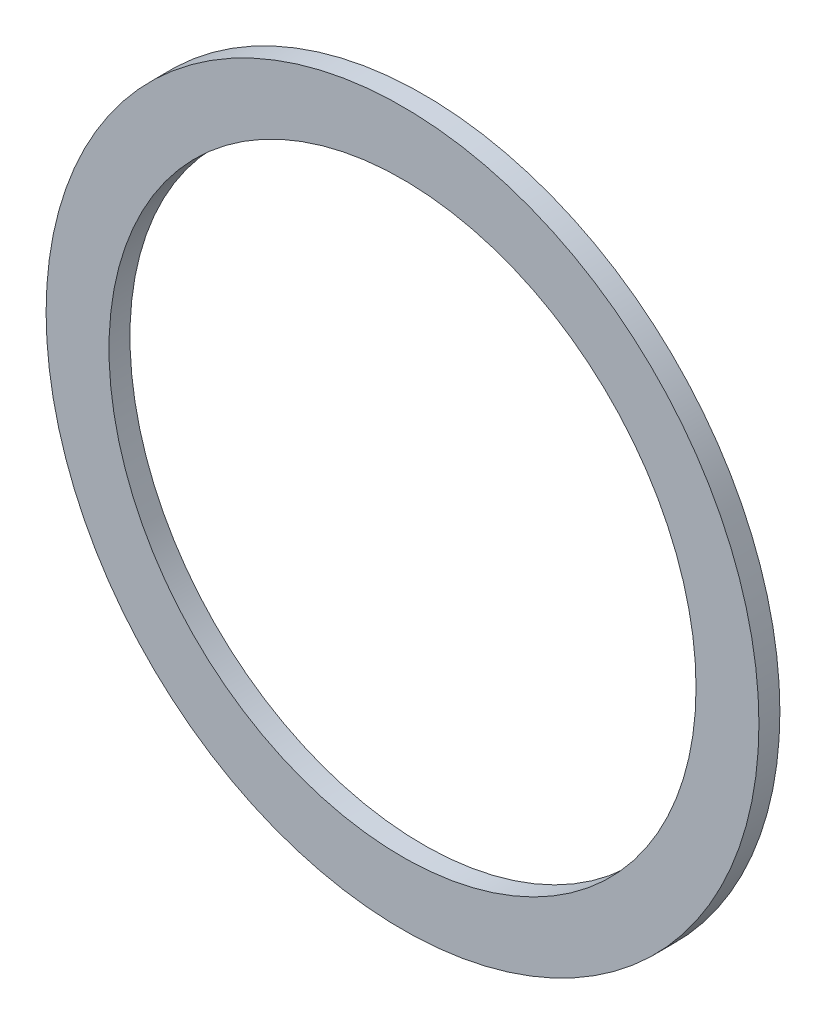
SolidWorks part; units mm, degrees
ref_plane "Front Plane" through (0, 0, 0) normal (0, 0, 1) x (1, 0, 0)
ref_plane "Top Plane" through (0, 0, 0) normal (0, 1, 0) x (1, 0, 0)
ref_plane "Right Plane" through (0, 0, 0) normal (1, 0, 0) x (0, 0, -1)
sketch "Sketch1" plane through (0, 0, 0) normal (0, 0, 1) x (1, 0, 0)
  circle A0 centre (0, 0) radius 26.9875
  circle A1 centre (0, 0) radius 22.225
  dimension "D1" = 53.975
  dimension "D2" = 44.45
extrude "Extrude1" add sketch "Sketch1" along normal blind 1.5875
